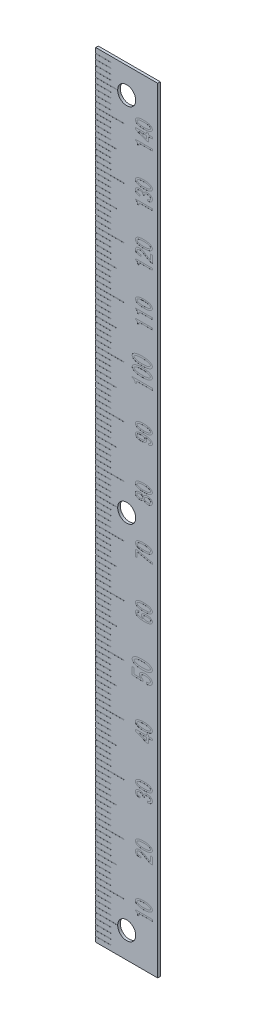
SolidWorks part; units mm, degrees
ref_plane "Front" through (0, 0, 0) normal (0, 0, 1) x (1, 0, 0)
ref_plane "Top" through (0, 0, 0) normal (0, 1, 0) x (1, 0, 0)
ref_plane "Right" through (0, 0, 0) normal (1, 0, 0) x (0, 0, -1)
sketch "Sketch1" plane through (0, 0, 0) normal (0, 0, 1) x (1, 0, 0)
  line L1 (0, 0) -> (0, 150)
  line L2 (0, 0) -> (12, 0)
  line L3 (12, 0) -> (12, 150)
  line L4 (0, 150) -> (12, 150)
  dimension "D1" = 150
  dimension "D2" = 12
extrude "Extrude1" add sketch "Sketch1" along normal blind 0.5
sketch "Sketch2" plane through (0, 0, 0.5) normal (0, 0, 1) x (1, 0, 0)
  line L0 (0, 150) -> (0, 0) construction
  line L1 (0, 0) -> (12, 0) construction
  line L2 (12, 150) -> (0, 150) construction
  circle A0 centre (6, 5) radius 1.75
  circle A1 centre (6, 145) radius 1.75
  circle A4 centre (6, 75) radius 1.75
  dimension "D1" = 6
  dimension "D2" = 6
  dimension "D3" = 5
  dimension "D4" = 5
  dimension "D5" = 3.5
  dimension "D6" = 3.5
  dimension "D8" = 2
extrude "Extrude2" cut sketch "Sketch2" against normal through all
sketch "Sketch3" plane through (0, 0, 0.5) normal (0, 0, 1) x (1, 0, 0)
  line L0 (12, 0) -> (12, 150) construction
  line L1 (7.5, 137.4) -> (11, 137.4) construction
  line L2 (7.5, 137.4) -> (7.5, 140.9) construction
  line L3 (7.5, 140.9) -> (11, 140.9) construction
  line L4 (11, 137.4) -> (11, 140.9) construction
  line L5 (11, 40) -> (-4.9003, 40) construction
  line L6 (11, 127.4) -> (11, 131.525) construction
  line L7 (11, 117.4) -> (11, 121.525) construction
  line L8 (11, 107.4) -> (11, 110.9) construction
  line L9 (11, 97.2) -> (11, 102.8) construction
  line L10 (11, 88.25) -> (11, 92.375) construction
  line L11 (11, 78.25) -> (11, 82.375) construction
  line L12 (11, 68.25) -> (11, 72.375) construction
  line L13 (11, 58.25) -> (11, 62.375) construction
  line L14 (11, 48) -> (11, 52) construction
  line L15 (11, 38.25) -> (11, 42.25) construction
  line L16 (11, 110) -> (-4.9003, 110) construction
  line L17 (11, 50) -> (-4.9003, 50) construction
  line L18 (11, 28.25) -> (11, 32.5) construction
  line L19 (11, 18.25) -> (11, 22.75) construction
  line L20 (11, 8.25) -> (11, 13) construction
  line L21 (11, 100) -> (-4.9003, 100) construction
  line L22 (11, 120) -> (-4.9003, 120) construction
  line L23 (11, 130) -> (-4.9003, 130) construction
  line L24 (11, 140) -> (-4.9003, 140) construction
  line L25 (11, 30) -> (-4.9003, 30) construction
  line L26 (11, 20) -> (-4.9003, 20) construction
  line L27 (11, 10) -> (-4.9003, 10) construction
  line L28 (11, 60) -> (-4.9003, 60) construction
  line L29 (11, 70) -> (-4.9003, 70) construction
  line L30 (11, 80) -> (-4.9003, 80) construction
  line L31 (11, 90) -> (-4.9003, 90) construction
  text T0 "140" font "ＭＳ ゴシック" height in points 11
  text T1 "130" font "ＭＳ ゴシック" height in points 11
  text T2 "120" font "ＭＳ ゴシック" height in points 11
  text T3 "110" font "ＭＳ ゴシック" height in points 11
  text T4 "100" font "ＭＳ ゴシック" height in points 13
  text T5 "90" font "ＭＳ ゴシック" height in points 11
  text T6 "80" font "ＭＳ ゴシック" height in points 11
  text T7 "70" font "ＭＳ ゴシック" height in points 11
  text T8 "60" font "ＭＳ ゴシック" height in points 11
  text T9 "50" font "ＭＳ ゴシック" height in points 13
  text T10 "40" font "ＭＳ ゴシック" height in points 11
  text T11 "30" font "ＭＳ ゴシック" height in points 11
  text T12 "20" font "ＭＳ ゴシック" height in points 11
  text T13 "10" font "ＭＳ ゴシック" height in points 11
  point P6 (11, 139.15)
  point P19 (11, 100)
  dimension "D1" = 3.5
  dimension "D2" = 2.6
  dimension "D3" = 5
  dimension "D4" = 3.5
  dimension "D8" = 2
  dimension "D9" = 50
  dimension "D10" = 2
  dimension "D11" = 5.6
  dimension "D12" = 2.6
  dimension "D5" = 3.5
  dimension "D13" = 2.6
  dimension "D14" = 2.6
  dimension "D15" = 1
  dimension "D16" = 1.75
  dimension "D19" = 1.75
  dimension "D20" = 1.75
  dimension "D21" = 1.75
  dimension "D22" = 1.75
  dimension "D23" = 1.75
  dimension "D24" = 1.75
  dimension "D7" = 1.75
  dimension "D6" = 5
  dimension "D17" = 4
  dimension "D18" = 2
extrude "Extrude3" cut sketch "Sketch3" against normal blind 0.01
sketch "Sketch4" plane through (0, 0, 0.5) normal (0, 0, 1) x (1, 0, 0)
  line L5 (12, 150) -> (0, 150) construction
  line L606 (6, 150) -> (6, 0) construction
  line L607 (0, 0) -> (12, 0) construction
  line L608 (3, 1.05) -> (3, 0.95)
  line L609 (0, 0.95) -> (3, 0.95)
  line L610 (0, 1.05) -> (3, 1.05)
  line L611 (0, 1.05) -> (0, 0.95)
  line L612 (3, 2.05) -> (3, 1.95)
  line L613 (0, 1.95) -> (3, 1.95)
  line L614 (0, 2.05) -> (3, 2.05)
  line L615 (0, 2.05) -> (0, 1.95)
  line L616 (3, 3.05) -> (3, 2.95)
  line L617 (0, 2.95) -> (3, 2.95)
  line L618 (0, 3.05) -> (3, 3.05)
  line L619 (0, 3.05) -> (0, 2.95)
  line L620 (3, 4.05) -> (3, 3.95)
  line L621 (0, 3.95) -> (3, 3.95)
  line L622 (0, 4.05) -> (3, 4.05)
  line L623 (0, 4.05) -> (0, 3.95)
  line L624 (3, 6.05) -> (3, 5.95)
  line L625 (0, 5.95) -> (3, 5.95)
  line L626 (0, 6.05) -> (3, 6.05)
  line L627 (0, 6.05) -> (0, 5.95)
  line L628 (3, 7.05) -> (3, 6.95)
  line L629 (0, 6.95) -> (3, 6.95)
  line L630 (0, 7.05) -> (3, 7.05)
  line L631 (0, 7.05) -> (0, 6.95)
  line L632 (3, 8.05) -> (3, 7.95)
  line L633 (0, 7.95) -> (3, 7.95)
  line L634 (0, 8.05) -> (3, 8.05)
  line L635 (3, 9.05) -> (3, 8.95)
  line L636 (0, 8.95) -> (3, 8.95)
  line L637 (0, 9.05) -> (0, 8.95)
  line L638 (0, 9.05) -> (3, 9.05)
  line L639 (4, 4.95) -> (4, 5.05)
  line L640 (0, 5.05) -> (4, 5.05)
  line L641 (0, 4.95) -> (0, 5.05)
  line L642 (0, 4.95) -> (4, 4.95)
  line L643 (0, 8.05) -> (0, 7.95)
  line L644 (0, 9.95) -> (0, 10.05)
  line L645 (5.5, 9.95) -> (0, 9.95)
  line L646 (5.5, 10.05) -> (5.5, 9.95)
  line L647 (0, 10.05) -> (5.5, 10.05)
  line L648 (3, 11.05) -> (3, 10.95)
  line L649 (0, 10.95) -> (3, 10.95)
  line L650 (0, 11.05) -> (3, 11.05)
  line L651 (0, 11.05) -> (0, 10.95)
  line L652 (3, 12.05) -> (3, 11.95)
  line L653 (0, 11.95) -> (3, 11.95)
  line L654 (0, 12.05) -> (3, 12.05)
  line L655 (0, 12.05) -> (0, 11.95)
  line L656 (3, 13.05) -> (3, 12.95)
  line L657 (0, 12.95) -> (3, 12.95)
  line L658 (0, 13.05) -> (3, 13.05)
  line L659 (0, 13.05) -> (0, 12.95)
  line L660 (3, 14.05) -> (3, 13.95)
  line L661 (0, 13.95) -> (3, 13.95)
  line L662 (0, 14.05) -> (3, 14.05)
  line L663 (0, 14.05) -> (0, 13.95)
  line L664 (3, 16.05) -> (3, 15.95)
  line L665 (0, 15.95) -> (3, 15.95)
  line L666 (0, 16.05) -> (3, 16.05)
  line L667 (0, 16.05) -> (0, 15.95)
  line L668 (3, 17.05) -> (3, 16.95)
  line L669 (0, 16.95) -> (3, 16.95)
  line L670 (0, 17.05) -> (3, 17.05)
  line L671 (0, 17.05) -> (0, 16.95)
  line L672 (3, 18.05) -> (3, 17.95)
  line L673 (0, 17.95) -> (3, 17.95)
  line L674 (0, 18.05) -> (3, 18.05)
  line L675 (3, 19.05) -> (3, 18.95)
  line L676 (0, 18.95) -> (3, 18.95)
  line L677 (0, 19.05) -> (0, 18.95)
  line L678 (0, 19.05) -> (3, 19.05)
  line L679 (4, 14.95) -> (4, 15.05)
  line L680 (0, 15.05) -> (4, 15.05)
  line L681 (0, 14.95) -> (0, 15.05)
  line L682 (0, 14.95) -> (4, 14.95)
  line L683 (0, 18.05) -> (0, 17.95)
  line L684 (0, 19.95) -> (0, 20.05)
  line L685 (5.5, 19.95) -> (0, 19.95)
  line L686 (5.5, 20.05) -> (5.5, 19.95)
  line L687 (0, 20.05) -> (5.5, 20.05)
  line L688 (3, 21.05) -> (3, 20.95)
  line L689 (0, 20.95) -> (3, 20.95)
  line L690 (0, 21.05) -> (3, 21.05)
  line L691 (0, 21.05) -> (0, 20.95)
  line L692 (3, 22.05) -> (3, 21.95)
  line L693 (0, 21.95) -> (3, 21.95)
  line L694 (0, 22.05) -> (3, 22.05)
  line L695 (0, 22.05) -> (0, 21.95)
  line L696 (3, 23.05) -> (3, 22.95)
  line L697 (0, 22.95) -> (3, 22.95)
  line L698 (0, 23.05) -> (3, 23.05)
  line L699 (0, 23.05) -> (0, 22.95)
  line L700 (3, 24.05) -> (3, 23.95)
  line L701 (0, 23.95) -> (3, 23.95)
  line L702 (0, 24.05) -> (3, 24.05)
  line L703 (0, 24.05) -> (0, 23.95)
  line L704 (3, 26.05) -> (3, 25.95)
  line L705 (0, 25.95) -> (3, 25.95)
  line L706 (0, 26.05) -> (3, 26.05)
  line L707 (0, 26.05) -> (0, 25.95)
  line L708 (3, 27.05) -> (3, 26.95)
  line L709 (0, 26.95) -> (3, 26.95)
  line L710 (0, 27.05) -> (3, 27.05)
  line L711 (0, 27.05) -> (0, 26.95)
  line L712 (3, 28.05) -> (3, 27.95)
  line L713 (0, 27.95) -> (3, 27.95)
  line L714 (0, 28.05) -> (3, 28.05)
  line L715 (3, 29.05) -> (3, 28.95)
  line L716 (0, 28.95) -> (3, 28.95)
  line L717 (0, 29.05) -> (0, 28.95)
  line L718 (0, 29.05) -> (3, 29.05)
  line L719 (4, 24.95) -> (4, 25.05)
  line L720 (0, 25.05) -> (4, 25.05)
  line L721 (0, 24.95) -> (0, 25.05)
  line L722 (0, 24.95) -> (4, 24.95)
  line L723 (0, 28.05) -> (0, 27.95)
  line L724 (0, 29.95) -> (0, 30.05)
  line L725 (5.5, 29.95) -> (0, 29.95)
  line L726 (5.5, 30.05) -> (5.5, 29.95)
  line L727 (0, 30.05) -> (5.5, 30.05)
  line L728 (3, 31.05) -> (3, 30.95)
  line L729 (0, 30.95) -> (3, 30.95)
  line L730 (0, 31.05) -> (3, 31.05)
  line L731 (0, 31.05) -> (0, 30.95)
  line L732 (3, 32.05) -> (3, 31.95)
  line L733 (0, 31.95) -> (3, 31.95)
  line L734 (0, 32.05) -> (3, 32.05)
  line L735 (0, 32.05) -> (0, 31.95)
  line L736 (3, 33.05) -> (3, 32.95)
  line L737 (0, 32.95) -> (3, 32.95)
  line L738 (0, 33.05) -> (3, 33.05)
  line L739 (0, 33.05) -> (0, 32.95)
  line L740 (3, 34.05) -> (3, 33.95)
  line L741 (0, 33.95) -> (3, 33.95)
  line L742 (0, 34.05) -> (3, 34.05)
  line L743 (0, 34.05) -> (0, 33.95)
  line L744 (3, 36.05) -> (3, 35.95)
  line L745 (0, 35.95) -> (3, 35.95)
  line L746 (0, 36.05) -> (3, 36.05)
  line L747 (0, 36.05) -> (0, 35.95)
  line L748 (3, 37.05) -> (3, 36.95)
  line L749 (0, 36.95) -> (3, 36.95)
  line L750 (0, 37.05) -> (3, 37.05)
  line L751 (0, 37.05) -> (0, 36.95)
  line L752 (3, 38.05) -> (3, 37.95)
  line L753 (0, 37.95) -> (3, 37.95)
  line L754 (0, 38.05) -> (3, 38.05)
  line L755 (3, 39.05) -> (3, 38.95)
  line L756 (0, 38.95) -> (3, 38.95)
  line L757 (0, 39.05) -> (0, 38.95)
  line L758 (0, 39.05) -> (3, 39.05)
  line L759 (4, 34.95) -> (4, 35.05)
  line L760 (0, 35.05) -> (4, 35.05)
  line L761 (0, 34.95) -> (0, 35.05)
  line L762 (0, 34.95) -> (4, 34.95)
  line L763 (0, 38.05) -> (0, 37.95)
  line L764 (0, 39.95) -> (0, 40.05)
  line L765 (5.5, 39.95) -> (0, 39.95)
  line L766 (5.5, 40.05) -> (5.5, 39.95)
  line L767 (0, 40.05) -> (5.5, 40.05)
  line L768 (3, 41.05) -> (3, 40.95)
  line L769 (0, 40.95) -> (3, 40.95)
  line L770 (0, 41.05) -> (3, 41.05)
  line L771 (0, 41.05) -> (0, 40.95)
  line L772 (3, 42.05) -> (3, 41.95)
  line L773 (0, 41.95) -> (3, 41.95)
  line L774 (0, 42.05) -> (3, 42.05)
  line L775 (0, 42.05) -> (0, 41.95)
  line L776 (3, 43.05) -> (3, 42.95)
  line L777 (0, 42.95) -> (3, 42.95)
  line L778 (0, 43.05) -> (3, 43.05)
  line L779 (0, 43.05) -> (0, 42.95)
  line L780 (3, 44.05) -> (3, 43.95)
  line L781 (0, 43.95) -> (3, 43.95)
  line L782 (0, 44.05) -> (3, 44.05)
  line L783 (0, 44.05) -> (0, 43.95)
  line L784 (3, 46.05) -> (3, 45.95)
  line L785 (0, 45.95) -> (3, 45.95)
  line L786 (0, 46.05) -> (3, 46.05)
  line L787 (0, 46.05) -> (0, 45.95)
  line L788 (3, 47.05) -> (3, 46.95)
  line L789 (0, 46.95) -> (3, 46.95)
  line L790 (0, 47.05) -> (3, 47.05)
  line L791 (0, 47.05) -> (0, 46.95)
  line L792 (3, 48.05) -> (3, 47.95)
  line L793 (0, 47.95) -> (3, 47.95)
  line L794 (0, 48.05) -> (3, 48.05)
  line L795 (3, 49.05) -> (3, 48.95)
  line L796 (0, 48.95) -> (3, 48.95)
  line L797 (0, 49.05) -> (0, 48.95)
  line L798 (0, 49.05) -> (3, 49.05)
  line L799 (4, 44.95) -> (4, 45.05)
  line L800 (0, 45.05) -> (4, 45.05)
  line L801 (0, 44.95) -> (0, 45.05)
  line L802 (0, 44.95) -> (4, 44.95)
  line L803 (0, 48.05) -> (0, 47.95)
  line L804 (0, 49.95) -> (0, 50.05)
  line L805 (5.5, 49.95) -> (0, 49.95)
  line L806 (5.5, 50.05) -> (5.5, 49.95)
  line L807 (0, 50.05) -> (5.5, 50.05)
  line L808 (3, 51.05) -> (3, 50.95)
  line L809 (0, 50.95) -> (3, 50.95)
  line L810 (0, 51.05) -> (3, 51.05)
  line L811 (0, 51.05) -> (0, 50.95)
  line L812 (3, 52.05) -> (3, 51.95)
  line L813 (0, 51.95) -> (3, 51.95)
  line L814 (0, 52.05) -> (3, 52.05)
  line L815 (0, 52.05) -> (0, 51.95)
  line L816 (3, 53.05) -> (3, 52.95)
  line L817 (0, 52.95) -> (3, 52.95)
  line L818 (0, 53.05) -> (3, 53.05)
  line L819 (0, 53.05) -> (0, 52.95)
  line L820 (3, 54.05) -> (3, 53.95)
  line L821 (0, 53.95) -> (3, 53.95)
  line L822 (0, 54.05) -> (3, 54.05)
  line L823 (0, 54.05) -> (0, 53.95)
  line L824 (3, 56.05) -> (3, 55.95)
  line L825 (0, 55.95) -> (3, 55.95)
  line L826 (0, 56.05) -> (3, 56.05)
  line L827 (0, 56.05) -> (0, 55.95)
  line L828 (3, 57.05) -> (3, 56.95)
  line L829 (0, 56.95) -> (3, 56.95)
  line L830 (0, 57.05) -> (3, 57.05)
  line L831 (0, 57.05) -> (0, 56.95)
  line L832 (3, 58.05) -> (3, 57.95)
  line L833 (0, 57.95) -> (3, 57.95)
  line L834 (0, 58.05) -> (3, 58.05)
  line L835 (3, 59.05) -> (3, 58.95)
  line L836 (0, 58.95) -> (3, 58.95)
  line L837 (0, 59.05) -> (0, 58.95)
  line L838 (0, 59.05) -> (3, 59.05)
  line L839 (4, 54.95) -> (4, 55.05)
  line L840 (0, 55.05) -> (4, 55.05)
  line L841 (0, 54.95) -> (0, 55.05)
  line L842 (0, 54.95) -> (4, 54.95)
  line L843 (0, 58.05) -> (0, 57.95)
  line L844 (0, 59.95) -> (0, 60.05)
  line L845 (5.5, 59.95) -> (0, 59.95)
  line L846 (5.5, 60.05) -> (5.5, 59.95)
  line L847 (0, 60.05) -> (5.5, 60.05)
  line L848 (3, 61.05) -> (3, 60.95)
  line L849 (0, 60.95) -> (3, 60.95)
  line L850 (0, 61.05) -> (3, 61.05)
  line L851 (0, 61.05) -> (0, 60.95)
  line L852 (3, 62.05) -> (3, 61.95)
  line L853 (0, 61.95) -> (3, 61.95)
  line L854 (0, 62.05) -> (3, 62.05)
  line L855 (0, 62.05) -> (0, 61.95)
  line L856 (3, 63.05) -> (3, 62.95)
  line L857 (0, 62.95) -> (3, 62.95)
  line L858 (0, 63.05) -> (3, 63.05)
  line L859 (0, 63.05) -> (0, 62.95)
  line L860 (3, 64.05) -> (3, 63.95)
  line L861 (0, 63.95) -> (3, 63.95)
  line L862 (0, 64.05) -> (3, 64.05)
  line L863 (0, 64.05) -> (0, 63.95)
  line L864 (3, 66.05) -> (3, 65.95)
  line L865 (0, 65.95) -> (3, 65.95)
  line L866 (0, 66.05) -> (3, 66.05)
  line L867 (0, 66.05) -> (0, 65.95)
  line L868 (3, 67.05) -> (3, 66.95)
  line L869 (0, 66.95) -> (3, 66.95)
  line L870 (0, 67.05) -> (3, 67.05)
  line L871 (0, 67.05) -> (0, 66.95)
  line L872 (3, 68.05) -> (3, 67.95)
  line L873 (0, 67.95) -> (3, 67.95)
  line L874 (0, 68.05) -> (3, 68.05)
  line L875 (3, 69.05) -> (3, 68.95)
  line L876 (0, 68.95) -> (3, 68.95)
  line L877 (0, 69.05) -> (0, 68.95)
  line L878 (0, 69.05) -> (3, 69.05)
  line L879 (4, 64.95) -> (4, 65.05)
  line L880 (0, 65.05) -> (4, 65.05)
  line L881 (0, 64.95) -> (0, 65.05)
  line L882 (0, 64.95) -> (4, 64.95)
  line L883 (0, 68.05) -> (0, 67.95)
  line L884 (0, 69.95) -> (0, 70.05)
  line L885 (5.5, 69.95) -> (0, 69.95)
  line L886 (5.5, 70.05) -> (5.5, 69.95)
  line L887 (0, 70.05) -> (5.5, 70.05)
  line L888 (3, 71.05) -> (3, 70.95)
  line L889 (0, 70.95) -> (3, 70.95)
  line L890 (0, 71.05) -> (3, 71.05)
  line L891 (0, 71.05) -> (0, 70.95)
  line L892 (3, 72.05) -> (3, 71.95)
  line L893 (0, 71.95) -> (3, 71.95)
  line L894 (0, 72.05) -> (3, 72.05)
  line L895 (0, 72.05) -> (0, 71.95)
  line L896 (3, 73.05) -> (3, 72.95)
  line L897 (0, 72.95) -> (3, 72.95)
  line L898 (0, 73.05) -> (3, 73.05)
  line L899 (0, 73.05) -> (0, 72.95)
  line L900 (3, 74.05) -> (3, 73.95)
  line L901 (0, 73.95) -> (3, 73.95)
  line L902 (0, 74.05) -> (3, 74.05)
  line L903 (0, 74.05) -> (0, 73.95)
  line L904 (3, 76.05) -> (3, 75.95)
  line L905 (0, 75.95) -> (3, 75.95)
  line L906 (0, 76.05) -> (3, 76.05)
  line L907 (0, 76.05) -> (0, 75.95)
  line L908 (3, 77.05) -> (3, 76.95)
  line L909 (0, 76.95) -> (3, 76.95)
  line L910 (0, 77.05) -> (3, 77.05)
  line L911 (0, 77.05) -> (0, 76.95)
  line L912 (3, 78.05) -> (3, 77.95)
  line L913 (0, 77.95) -> (3, 77.95)
  line L914 (0, 78.05) -> (3, 78.05)
  line L915 (3, 79.05) -> (3, 78.95)
  line L916 (0, 78.95) -> (3, 78.95)
  line L917 (0, 79.05) -> (0, 78.95)
  line L918 (0, 79.05) -> (3, 79.05)
  line L919 (4, 74.95) -> (4, 75.05)
  line L920 (0, 75.05) -> (4, 75.05)
  line L921 (0, 74.95) -> (0, 75.05)
  line L922 (0, 74.95) -> (4, 74.95)
  line L923 (0, 78.05) -> (0, 77.95)
  line L924 (0, 79.95) -> (0, 80.05)
  line L925 (5.5, 79.95) -> (0, 79.95)
  line L926 (5.5, 80.05) -> (5.5, 79.95)
  line L927 (0, 80.05) -> (5.5, 80.05)
  line L928 (3, 81.05) -> (3, 80.95)
  line L929 (0, 80.95) -> (3, 80.95)
  line L930 (0, 81.05) -> (3, 81.05)
  line L931 (0, 81.05) -> (0, 80.95)
  line L932 (3, 82.05) -> (3, 81.95)
  line L933 (0, 81.95) -> (3, 81.95)
  line L934 (0, 82.05) -> (3, 82.05)
  line L935 (0, 82.05) -> (0, 81.95)
  line L936 (3, 83.05) -> (3, 82.95)
  line L937 (0, 82.95) -> (3, 82.95)
  line L938 (0, 83.05) -> (3, 83.05)
  line L939 (0, 83.05) -> (0, 82.95)
  line L940 (3, 84.05) -> (3, 83.95)
  line L941 (0, 83.95) -> (3, 83.95)
  line L942 (0, 84.05) -> (3, 84.05)
  line L943 (0, 84.05) -> (0, 83.95)
  line L944 (3, 86.05) -> (3, 85.95)
  line L945 (0, 85.95) -> (3, 85.95)
  line L946 (0, 86.05) -> (3, 86.05)
  line L947 (0, 86.05) -> (0, 85.95)
  line L948 (3, 87.05) -> (3, 86.95)
  line L949 (0, 86.95) -> (3, 86.95)
  line L950 (0, 87.05) -> (3, 87.05)
  line L951 (0, 87.05) -> (0, 86.95)
  line L952 (3, 88.05) -> (3, 87.95)
  line L953 (0, 87.95) -> (3, 87.95)
  line L954 (0, 88.05) -> (3, 88.05)
  line L955 (3, 89.05) -> (3, 88.95)
  line L956 (0, 88.95) -> (3, 88.95)
  line L957 (0, 89.05) -> (0, 88.95)
  line L958 (0, 89.05) -> (3, 89.05)
  line L959 (4, 84.95) -> (4, 85.05)
  line L960 (0, 85.05) -> (4, 85.05)
  line L961 (0, 84.95) -> (0, 85.05)
  line L962 (0, 84.95) -> (4, 84.95)
  line L963 (0, 88.05) -> (0, 87.95)
  line L964 (0, 89.95) -> (0, 90.05)
  line L965 (5.5, 89.95) -> (0, 89.95)
  line L966 (5.5, 90.05) -> (5.5, 89.95)
  line L967 (0, 90.05) -> (5.5, 90.05)
  line L968 (3, 91.05) -> (3, 90.95)
  line L969 (0, 90.95) -> (3, 90.95)
  line L970 (0, 91.05) -> (3, 91.05)
  line L971 (0, 91.05) -> (0, 90.95)
  line L972 (3, 92.05) -> (3, 91.95)
  line L973 (0, 91.95) -> (3, 91.95)
  line L974 (0, 92.05) -> (3, 92.05)
  line L975 (0, 92.05) -> (0, 91.95)
  line L976 (3, 93.05) -> (3, 92.95)
  line L977 (0, 92.95) -> (3, 92.95)
  line L978 (0, 93.05) -> (3, 93.05)
  line L979 (0, 93.05) -> (0, 92.95)
  line L980 (3, 94.05) -> (3, 93.95)
  line L981 (0, 93.95) -> (3, 93.95)
  line L982 (0, 94.05) -> (3, 94.05)
  line L983 (0, 94.05) -> (0, 93.95)
  line L984 (3, 96.05) -> (3, 95.95)
  line L985 (0, 95.95) -> (3, 95.95)
  line L986 (0, 96.05) -> (3, 96.05)
  line L987 (0, 96.05) -> (0, 95.95)
  line L988 (3, 97.05) -> (3, 96.95)
  line L989 (0, 96.95) -> (3, 96.95)
  line L990 (0, 97.05) -> (3, 97.05)
  line L991 (0, 97.05) -> (0, 96.95)
  line L992 (3, 98.05) -> (3, 97.95)
  line L993 (0, 97.95) -> (3, 97.95)
  line L994 (0, 98.05) -> (3, 98.05)
  line L995 (3, 99.05) -> (3, 98.95)
  line L996 (0, 98.95) -> (3, 98.95)
  line L997 (0, 99.05) -> (0, 98.95)
  line L998 (0, 99.05) -> (3, 99.05)
  line L999 (4, 94.95) -> (4, 95.05)
  line L1000 (0, 95.05) -> (4, 95.05)
  line L1001 (0, 94.95) -> (0, 95.05)
  line L1002 (0, 94.95) -> (4, 94.95)
  line L1003 (0, 98.05) -> (0, 97.95)
  line L1004 (3, 101.05) -> (3, 100.95)
  line L1005 (0, 100.95) -> (3, 100.95)
  line L1006 (0, 101.05) -> (3, 101.05)
  line L1007 (0, 101.05) -> (0, 100.95)
  line L1008 (3, 102.05) -> (3, 101.95)
  line L1009 (0, 101.95) -> (3, 101.95)
  line L1010 (0, 102.05) -> (3, 102.05)
  line L1011 (0, 102.05) -> (0, 101.95)
  line L1012 (3, 103.05) -> (3, 102.95)
  line L1013 (0, 102.95) -> (3, 102.95)
  line L1014 (0, 103.05) -> (3, 103.05)
  line L1015 (0, 103.05) -> (0, 102.95)
  line L1016 (3, 104.05) -> (3, 103.95)
  line L1017 (0, 103.95) -> (3, 103.95)
  line L1018 (0, 104.05) -> (3, 104.05)
  line L1019 (0, 104.05) -> (0, 103.95)
  line L1020 (3, 106.05) -> (3, 105.95)
  line L1021 (0, 105.95) -> (3, 105.95)
  line L1022 (0, 106.05) -> (3, 106.05)
  line L1023 (0, 106.05) -> (0, 105.95)
  line L1024 (3, 107.05) -> (3, 106.95)
  line L1025 (0, 106.95) -> (3, 106.95)
  line L1026 (0, 107.05) -> (3, 107.05)
  line L1027 (0, 107.05) -> (0, 106.95)
  line L1028 (3, 108.05) -> (3, 107.95)
  line L1029 (0, 107.95) -> (3, 107.95)
  line L1030 (0, 108.05) -> (3, 108.05)
  line L1031 (3, 109.05) -> (3, 108.95)
  line L1032 (0, 108.95) -> (3, 108.95)
  line L1033 (0, 109.05) -> (0, 108.95)
  line L1034 (0, 109.05) -> (3, 109.05)
  line L1035 (4, 104.95) -> (4, 105.05)
  line L1036 (0, 105.05) -> (4, 105.05)
  line L1037 (0, 104.95) -> (0, 105.05)
  line L1038 (0, 104.95) -> (4, 104.95)
  line L1039 (0, 108.05) -> (0, 107.95)
  line L1040 (0, 99.95) -> (0, 100.05)
  line L1041 (5.5, 99.95) -> (0, 99.95)
  line L1042 (5.5, 100.05) -> (5.5, 99.95)
  line L1043 (0, 100.05) -> (5.5, 100.05)
  line L1044 (3, 111.05) -> (3, 110.95)
  line L1045 (0, 110.95) -> (3, 110.95)
  line L1046 (0, 111.05) -> (3, 111.05)
  line L1047 (0, 111.05) -> (0, 110.95)
  line L1048 (3, 112.05) -> (3, 111.95)
  line L1049 (0, 111.95) -> (3, 111.95)
  line L1050 (0, 112.05) -> (3, 112.05)
  line L1051 (0, 112.05) -> (0, 111.95)
  line L1052 (3, 113.05) -> (3, 112.95)
  line L1053 (0, 112.95) -> (3, 112.95)
  line L1054 (0, 113.05) -> (3, 113.05)
  line L1055 (0, 113.05) -> (0, 112.95)
  line L1056 (3, 114.05) -> (3, 113.95)
  line L1057 (0, 113.95) -> (3, 113.95)
  line L1058 (0, 114.05) -> (3, 114.05)
  line L1059 (0, 114.05) -> (0, 113.95)
  line L1060 (3, 116.05) -> (3, 115.95)
  line L1061 (0, 115.95) -> (3, 115.95)
  line L1062 (0, 116.05) -> (3, 116.05)
  line L1063 (0, 116.05) -> (0, 115.95)
  line L1064 (3, 117.05) -> (3, 116.95)
  line L1065 (0, 116.95) -> (3, 116.95)
  line L1066 (0, 117.05) -> (3, 117.05)
  line L1067 (0, 117.05) -> (0, 116.95)
  line L1068 (3, 118.05) -> (3, 117.95)
  line L1069 (0, 117.95) -> (3, 117.95)
  line L1070 (0, 118.05) -> (3, 118.05)
  line L1071 (3, 119.05) -> (3, 118.95)
  line L1072 (0, 118.95) -> (3, 118.95)
  line L1073 (0, 119.05) -> (0, 118.95)
  line L1074 (0, 119.05) -> (3, 119.05)
  line L1075 (4, 114.95) -> (4, 115.05)
  line L1076 (0, 115.05) -> (4, 115.05)
  line L1077 (0, 114.95) -> (0, 115.05)
  line L1078 (0, 114.95) -> (4, 114.95)
  line L1079 (0, 118.05) -> (0, 117.95)
  line L1080 (0, 109.95) -> (0, 110.05)
  line L1081 (5.5, 109.95) -> (0, 109.95)
  line L1082 (5.5, 110.05) -> (5.5, 109.95)
  line L1083 (0, 110.05) -> (5.5, 110.05)
  line L1084 (3, 121.05) -> (3, 120.95)
  line L1085 (0, 120.95) -> (3, 120.95)
  line L1086 (0, 121.05) -> (3, 121.05)
  line L1087 (0, 121.05) -> (0, 120.95)
  line L1088 (3, 122.05) -> (3, 121.95)
  line L1089 (0, 121.95) -> (3, 121.95)
  line L1090 (0, 122.05) -> (3, 122.05)
  line L1091 (0, 122.05) -> (0, 121.95)
  line L1092 (3, 123.05) -> (3, 122.95)
  line L1093 (0, 122.95) -> (3, 122.95)
  line L1094 (0, 123.05) -> (3, 123.05)
  line L1095 (0, 123.05) -> (0, 122.95)
  line L1096 (3, 124.05) -> (3, 123.95)
  line L1097 (0, 123.95) -> (3, 123.95)
  line L1098 (0, 124.05) -> (3, 124.05)
  line L1099 (0, 124.05) -> (0, 123.95)
  line L1100 (3, 126.05) -> (3, 125.95)
  line L1101 (0, 125.95) -> (3, 125.95)
  line L1102 (0, 126.05) -> (3, 126.05)
  line L1103 (0, 126.05) -> (0, 125.95)
  line L1104 (3, 127.05) -> (3, 126.95)
  line L1105 (0, 126.95) -> (3, 126.95)
  line L1106 (0, 127.05) -> (3, 127.05)
  line L1107 (0, 127.05) -> (0, 126.95)
  line L1108 (3, 128.05) -> (3, 127.95)
  line L1109 (0, 127.95) -> (3, 127.95)
  line L1110 (0, 128.05) -> (3, 128.05)
  line L1111 (3, 129.05) -> (3, 128.95)
  line L1112 (0, 128.95) -> (3, 128.95)
  line L1113 (0, 129.05) -> (0, 128.95)
  line L1114 (0, 129.05) -> (3, 129.05)
  line L1115 (4, 124.95) -> (4, 125.05)
  line L1116 (0, 125.05) -> (4, 125.05)
  line L1117 (0, 124.95) -> (0, 125.05)
  line L1118 (0, 124.95) -> (4, 124.95)
  line L1119 (0, 128.05) -> (0, 127.95)
  line L1120 (0, 119.95) -> (0, 120.05)
  line L1121 (5.5, 119.95) -> (0, 119.95)
  line L1122 (5.5, 120.05) -> (5.5, 119.95)
  line L1123 (0, 120.05) -> (5.5, 120.05)
  line L1124 (3, 131.05) -> (3, 130.95)
  line L1125 (0, 130.95) -> (3, 130.95)
  line L1126 (0, 131.05) -> (3, 131.05)
  line L1127 (0, 131.05) -> (0, 130.95)
  line L1128 (3, 132.05) -> (3, 131.95)
  line L1129 (0, 131.95) -> (3, 131.95)
  line L1130 (0, 132.05) -> (3, 132.05)
  line L1131 (0, 132.05) -> (0, 131.95)
  line L1132 (3, 133.05) -> (3, 132.95)
  line L1133 (0, 132.95) -> (3, 132.95)
  line L1134 (0, 133.05) -> (3, 133.05)
  line L1135 (0, 133.05) -> (0, 132.95)
  line L1136 (3, 134.05) -> (3, 133.95)
  line L1137 (0, 133.95) -> (3, 133.95)
  line L1138 (0, 134.05) -> (3, 134.05)
  line L1139 (0, 134.05) -> (0, 133.95)
  line L1140 (3, 136.05) -> (3, 135.95)
  line L1141 (0, 135.95) -> (3, 135.95)
  line L1142 (0, 136.05) -> (3, 136.05)
  line L1143 (0, 136.05) -> (0, 135.95)
  line L1144 (3, 137.05) -> (3, 136.95)
  line L1145 (0, 136.95) -> (3, 136.95)
  line L1146 (0, 137.05) -> (3, 137.05)
  line L1147 (0, 137.05) -> (0, 136.95)
  line L1148 (3, 138.05) -> (3, 137.95)
  line L1149 (0, 137.95) -> (3, 137.95)
  line L1150 (0, 138.05) -> (3, 138.05)
  line L1151 (3, 139.05) -> (3, 138.95)
  line L1152 (0, 138.95) -> (3, 138.95)
  line L1153 (0, 139.05) -> (0, 138.95)
  line L1154 (0, 139.05) -> (3, 139.05)
  line L1155 (4, 134.95) -> (4, 135.05)
  line L1156 (0, 135.05) -> (4, 135.05)
  line L1157 (0, 134.95) -> (0, 135.05)
  line L1158 (0, 134.95) -> (4, 134.95)
  line L1159 (0, 138.05) -> (0, 137.95)
  line L1160 (3, 141.05) -> (3, 140.95)
  line L1161 (0, 140.95) -> (3, 140.95)
  line L1162 (0, 141.05) -> (3, 141.05)
  line L1163 (0, 141.05) -> (0, 140.95)
  line L1164 (3, 142.05) -> (3, 141.95)
  line L1165 (0, 141.95) -> (3, 141.95)
  line L1166 (0, 142.05) -> (3, 142.05)
  line L1167 (0, 142.05) -> (0, 141.95)
  line L1168 (3, 143.05) -> (3, 142.95)
  line L1169 (0, 142.95) -> (3, 142.95)
  line L1170 (0, 143.05) -> (3, 143.05)
  line L1171 (0, 143.05) -> (0, 142.95)
  line L1172 (3, 144.05) -> (3, 143.95)
  line L1173 (0, 143.95) -> (3, 143.95)
  line L1174 (0, 144.05) -> (3, 144.05)
  line L1175 (0, 144.05) -> (0, 143.95)
  line L1176 (0, 129.95) -> (0, 130.05)
  line L1177 (5.5, 129.95) -> (0, 129.95)
  line L1178 (5.5, 130.05) -> (5.5, 129.95)
  line L1179 (0, 130.05) -> (5.5, 130.05)
  line L1180 (3, 146.05) -> (3, 145.95)
  line L1181 (0, 145.95) -> (3, 145.95)
  line L1182 (0, 146.05) -> (3, 146.05)
  line L1183 (0, 146.05) -> (0, 145.95)
  line L1184 (3, 147.05) -> (3, 146.95)
  line L1185 (0, 146.95) -> (3, 146.95)
  line L1186 (0, 147.05) -> (3, 147.05)
  line L1187 (0, 147.05) -> (0, 146.95)
  line L1188 (3, 148.05) -> (3, 147.95)
  line L1189 (0, 147.95) -> (3, 147.95)
  line L1190 (0, 148.05) -> (3, 148.05)
  line L1191 (3, 149.05) -> (3, 148.95)
  line L1192 (0, 148.95) -> (3, 148.95)
  line L1193 (0, 149.05) -> (0, 148.95)
  line L1194 (0, 149.05) -> (3, 149.05)
  line L1195 (4, 144.95) -> (4, 145.05)
  line L1196 (0, 145.05) -> (4, 145.05)
  line L1197 (0, 144.95) -> (0, 145.05)
  line L1198 (0, 144.95) -> (4, 144.95)
  line L1199 (0, 148.05) -> (0, 147.95)
  line L1200 (0, 139.95) -> (0, 140.05)
  line L1201 (5.5, 139.95) -> (0, 139.95)
  line L1202 (5.5, 140.05) -> (5.5, 139.95)
  line L1203 (0, 140.05) -> (5.5, 140.05)
extrude "Extrude4" cut sketch "Sketch4" against normal blind 0.01
move or copy body "Body-Move/Copy2" bodies to move or copy 105 copy no translate (-12, 0, 0)
